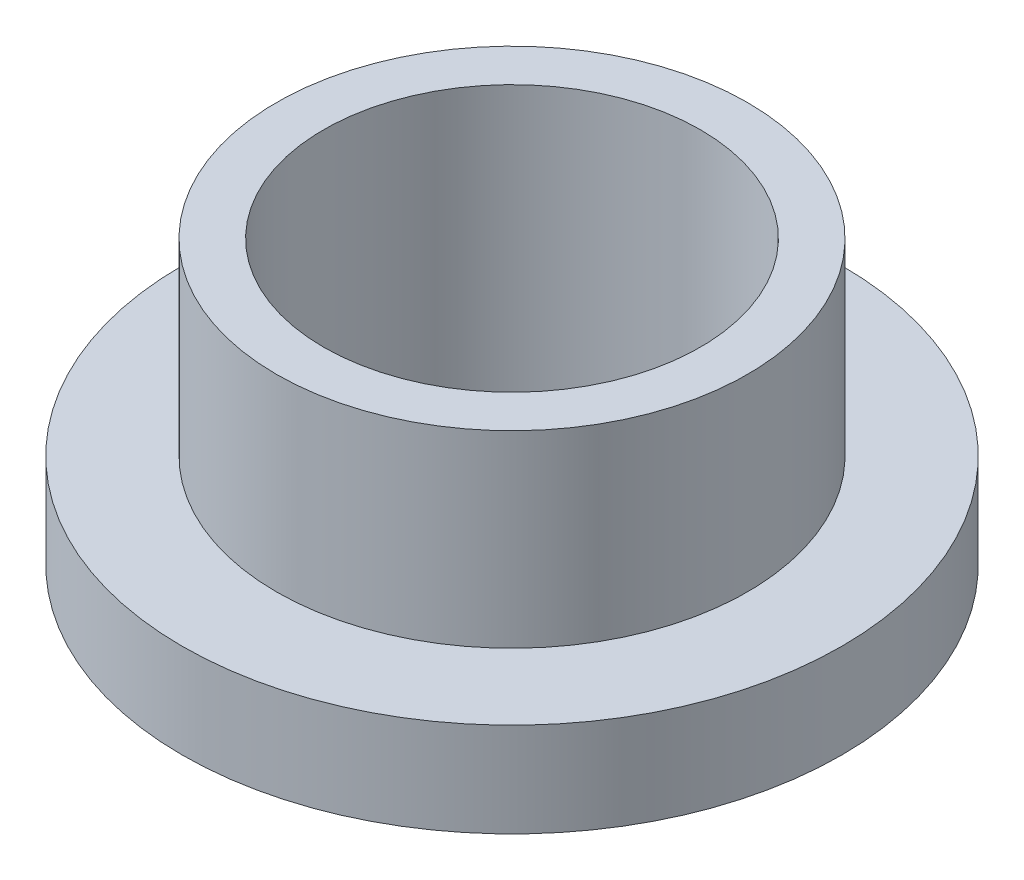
SolidWorks part; units mm, degrees
ref_plane "Front Plane" through (0, 0, 0) normal (0, 0, 1) x (1, 0, 0)
ref_plane "Top Plane" through (0, 0, 0) normal (0, 1, 0) x (1, 0, 0)
ref_plane "Right Plane" through (0, 0, 0) normal (1, 0, 0) x (0, 0, -1)
sketch "Sketch1" plane through (0, 0, 0) normal (0, 1, 0) x (1, 0, 0)
  circle A0 centre (0, 0) radius 6.35
  circle A1 centre (0, 0) radius 7.9375
  dimension "D1" = 12.7
  dimension "D2" = 15.875
extrude "Boss-Extrude1" add sketch "Sketch1" along normal blind 9.525
sketch "Sketch2" plane through (0, 0, 0) normal (0, -1, 0) x (1, 0, 0)
  circle A0 centre (0, 0) radius 11.1125
  circle A1 centre (0, 0) radius 6.35
extrude "Boss-Extrude2" add sketch "Sketch2" against normal blind 3.175
